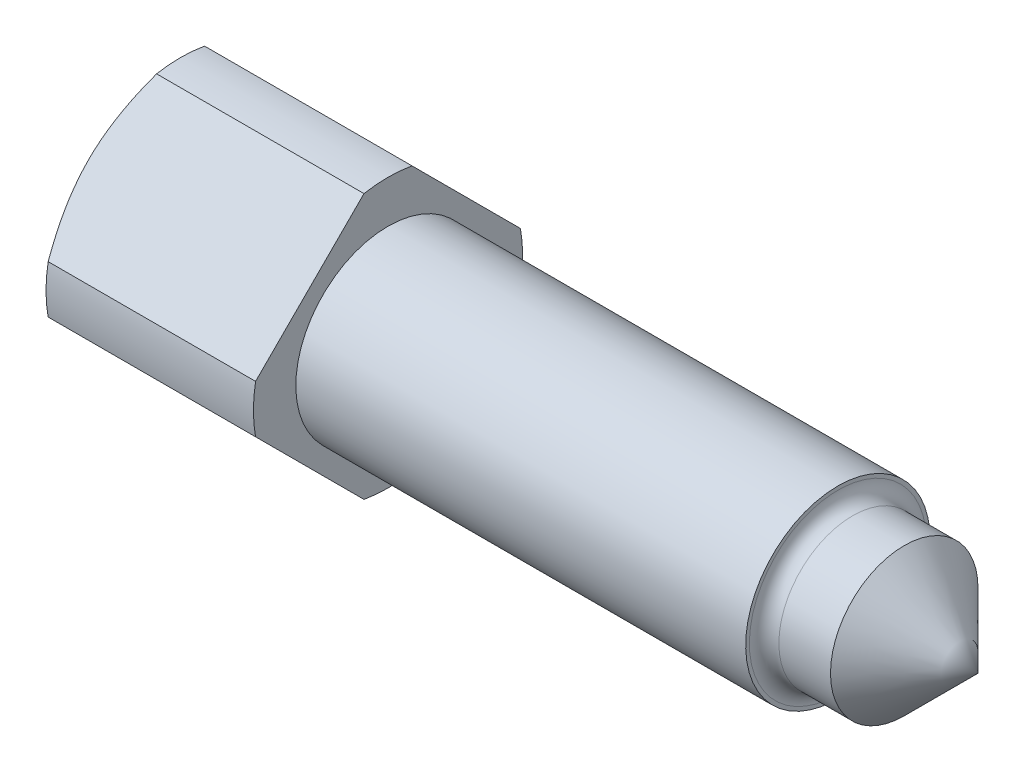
SolidWorks part; units mm, degrees
ref_plane "Front" through (0, 0, 0) normal (0, 0, 1) x (1, 0, 0)
ref_plane "Top" through (0, 0, 0) normal (0, 1, 0) x (1, 0, 0)
ref_plane "Right" through (0, 0, 0) normal (1, 0, 0) x (0, 0, -1)
sketch "Sketch1" plane through (0, 0, 0) normal (1, 0, 0) x (0, 0, -1)
  circle A0 centre (0, 0) radius 3.65
  dimension "e" = 7.3
extrude "BaseHead" add sketch "Sketch1" along normal blind 6
sketch "Sketch2" plane through (0, 2.6629, -1.4921) normal (-1, 0, 0) x (0, 0, 1)
  line L1 (5.7347, -2.6629) -> (1.4921, 1.5797)
  line L2 (1.4921, 1.5797) -> (-2.7505, -2.6629)
  line L3 (-2.7505, -2.6629) -> (1.4921, -6.9056)
  line L4 (1.4921, -6.9056) -> (5.7347, -2.6629)
  circle A0 centre (1.4921, -2.6629) radius 3 construction
  dimension "s" = 6
extrude "Cut-Extrude1" cut sketch "Sketch2" against normal blind 6 flip side to cut
sketch "Sketch3" plane through (1.2597, -5.2747, 0) normal (0, 0, 1) x (0, -1, 0)
  line L0 (-9.2897, -1.2597) -> (-8.2747, -1.2597)
  line L2 (-8.2747, -1.2597) -> (-9.2897, -0.6737)
  line L3 (-9.2897, -0.6737) -> (-9.2897, -1.2597)
  line L4 (-5.2747, 0.2856) -> (-5.2747, -6.82) construction
  line L6 (-5.9259, -1.2597) -> (-8.8662, -1.2597) construction
  dimension "D1" = 8.03
  dimension "d2" = 6
  dimension "D3" = 30
revolve "Cut-Revolve1" cut sketch "Sketch3" angle 360 about L4
sketch "Sketch4" plane through (-10.3472, 12.8472, 0) normal (0, 0, 1) x (0, -1, 0)
  line L0 (12.8472, 16.3472) -> (15.3472, 16.3472)
  line L1 (12.8472, 32.3472) -> (14.8472, 30.3472)
  line L2 (15.3472, 16.3472) -> (15.3472, 28.5472)
  line L3 (12.196, 16.3472) -> (9.2558, 16.3472) construction
  line L4 (14.8472, 28.5472) -> (14.8472, 30.3472)
  line L5 (12.8472, 32.3472) -> (12.8472, 16.3472)
  line L6 (12.8472, 24.434) -> (12.8472, -1.2396) construction
  line L8 (15.3472, 28.5472) -> (14.8472, 28.5472)
  dimension "D2" = 45
  dimension "d" = 5
  dimension "l" = 16
  dimension "dp" = 4
  dimension "z" = 3.8
revolve "BaseBody" add sketch "Sketch4" angle 360 about L6
fillet "Fillet1" radius 0.4 1 edges at (18.2, 2, 0)
fillet "HeadFillet" [suppressed] radius 0.2
sketch "Sketch5" plane through (0, 0, 0) normal (0, 0, 1) x (1, 0, 0)
  line L0 (18.2, 2.2835) -> (18.325, 2.5)
  line L1 (18.325, 2.5) -> (18.325, 2.75)
  line L2 (18.325, 2.75) -> (18.075, 2.75)
  line L3 (18.075, 2.75) -> (18.075, 2.5)
  line L4 (18.075, 2.5) -> (18.2, 2.2835)
  line L5 (0, 0) -> (22.7829, 0) construction
  line L6 (0, 2.1213) -> (0, -2.1213) construction
  line L7 (18.2, -2.5) -> (18.2, 2.5) construction
  dimension "D1" = 5
  dimension "D2" = 0.25
revolve "Cut-Revolve10" [suppressed] cut sketch "Sketch5" angle 360 about L5
pattern_linear "LPattern10" [suppressed] count 30 spacing 0.3 along (1, 0, 0)
equation "\"D1@Fillet1\" = 2 * \"r@HeadFillet\""
equation "\"d2@Sketch3\" = \"s@Sketch2\""
equation "\"D1@Sketch3\" = \"e@Sketch1\" * 1.1"
equation "\"k+c@BaseHead\" = \"k@Cut-Extrude1\""
equation "\"D1@Sketch5\" = \"d@Sketch4\""
equation "\"D2@Sketch5\" =  ( \"d@Sketch4\" - \"d@ThreadCosmetic1\" )  / 2"
equation "\"D3@LPattern10\" = \"D2@Sketch5\" * 1.2"
equation "\"D1@LPattern10\" = \"D1@ThreadCosmetic1\" / \"D3@LPattern10\""
